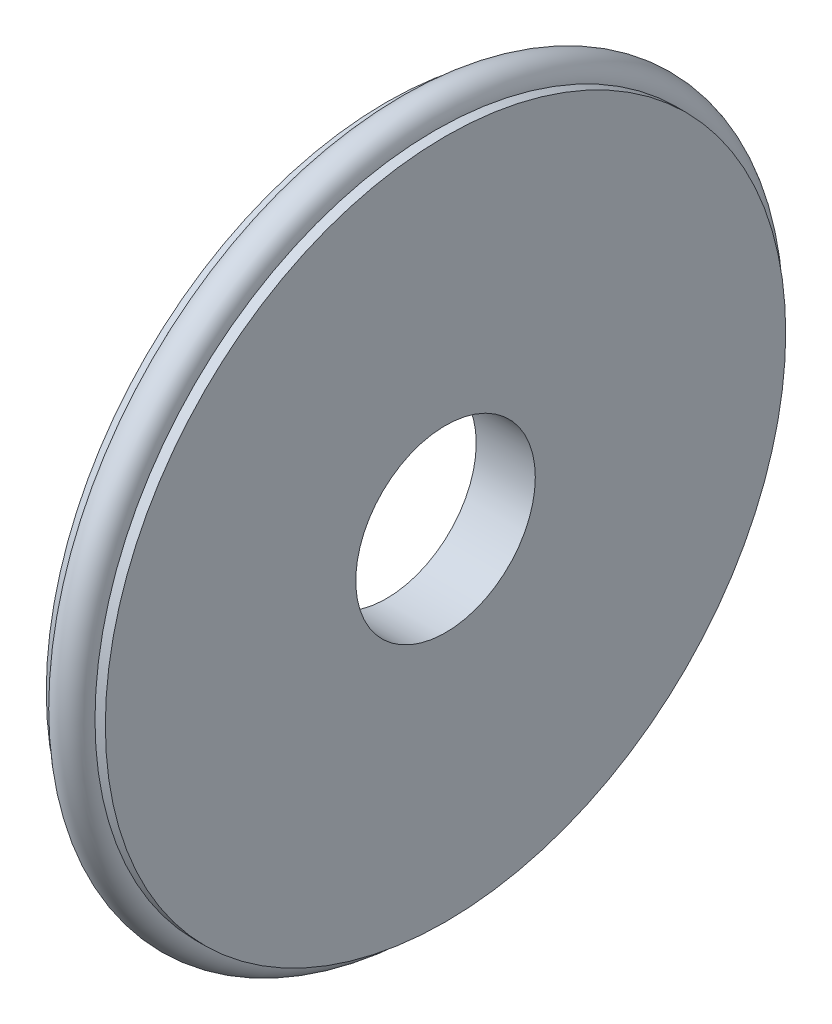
SolidWorks part; units mm, degrees
ref_plane "Front Plane" through (0, 0, 0) normal (0, 0, 1) x (1, 0, 0)
ref_plane "Top Plane" through (0, 0, 0) normal (0, 1, 0) x (1, 0, 0)
ref_plane "Right Plane" through (0, 0, 0) normal (1, 0, 0) x (0, 0, -1)
sketch "Sketch1" plane through (0, 0, 0) normal (0, 0, 1) x (1, 0, 0)
  line L0 (-3.125, 0) -> (3.125, 0)
  line L1 (-3.125, 0) -> (-3.125, 36)
  line L2 (3.125, 0) -> (3.125, 36)
  line L3 (-3.125, 36) -> (-2, 36)
  line L4 (3.125, 36) -> (2, 36)
  line L5 (-22.9962, 0) -> (22.9962, 0) construction
  arc A0 (-2, 36) -> (2, 36) centre (0, 36) ccw
  point P3 (0, 0)
  point P11 (0, 0)
  dimension "D6" = 2
  dimension "D1" = 6.25
  dimension "D2" = 36
  dimension "D3" = 36
  dimension "D4" = 1.125
  dimension "D5" = 1.125
revolve "Revolve1" add sketch "Sketch1" angle 360 about L5
hole_wizard "Ø19.0 (19) Diameter Hole1" positions "Sketch3" profile "Sketch2" hole size "Ø19.0" standard "Ansi Metric"
sketch "Sketch3" plane through (3.125, 0, 0) normal (1, 0, 0) x (0, 0, -1)
  point P0 (0, 0)
sketch "Sketch2" plane through (3.125, 0, 0) normal (0, 1, 0) x (0, 0, -1)
  line L0 (0, 0) -> (0, 6.25)
  line L1 (0, 6.25) -> (9.5, 6.25)
  line L2 (9.5, 6.25) -> (9.5, 0)
  line L5 (9.5, 0) -> (0, 0)
  line L11 (0, -6.35) -> (0, 107.95) construction
  dimension "Thru Hole Dia." = 19
  dimension "Thru Hole Depth" = 6.25
sketch "Sketch4" plane through (0, 0, 0) normal (0, 1, 0) x (1, 0, 0)
  circle A0 centre (0, 36) radius 2.0286
ref_axis "Axis1" through (-3.125, 0, 0) along (1, 0, 0)
revolve "Revolve2" add sketch "Sketch4" angle 360 about axis through (-3.125, 0, 0) along (1, 0, 0)
